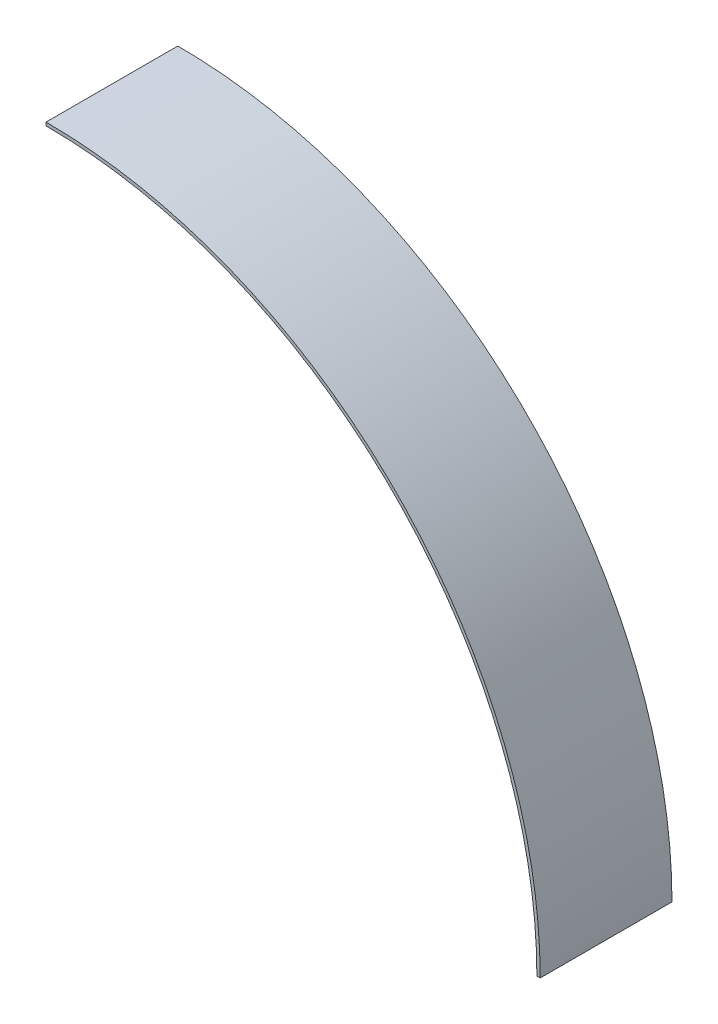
SolidWorks part; units mm, degrees
ref_plane "Vorne" through (0, 0, 0) normal (0, 0, 1) x (1, 0, 0)
ref_plane "Oben" through (0, 0, 0) normal (0, 1, 0) x (1, 0, 0)
ref_plane "Rechts" through (0, 0, 0) normal (1, 0, 0) x (0, 0, -1)
sketch "Skizze1" plane through (0, 0, 0) normal (0, 0, 1) x (1, 0, 0)
  line L0 (0, 76.5464) -> (0, 0) construction
  line L1 (0, 0) -> (75, 0) construction
  arc A0 (75, 0) -> (0, 75) centre (0, 0) ccw
  dimension "D1" = 150
extrude "Linear-Austragen-Dünn1" add sketch "Skizze1" along normal blind 20 thin
